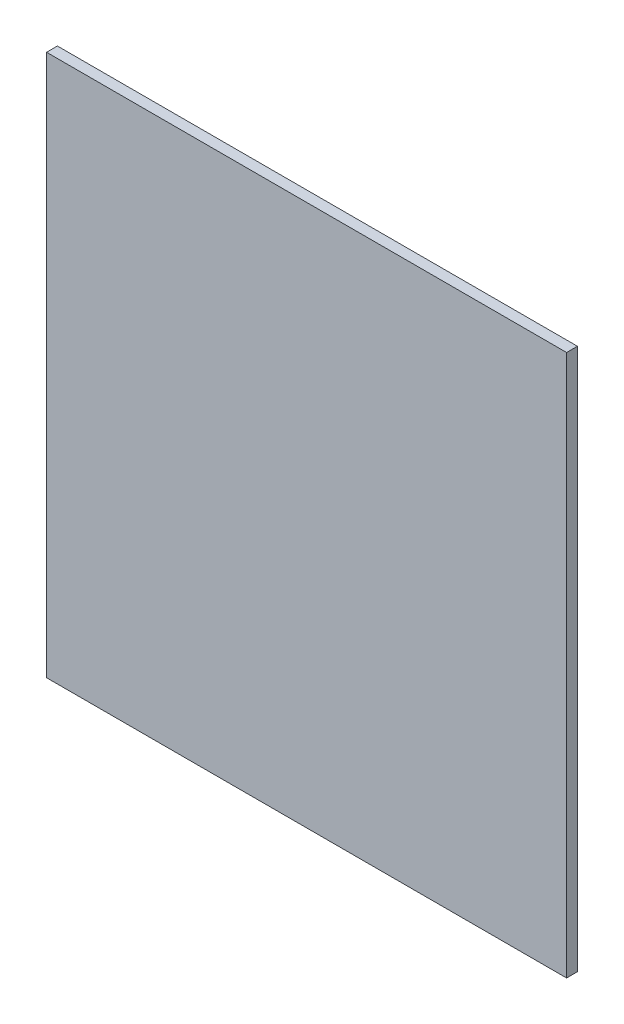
SolidWorks part; units mm, degrees
ref_plane "Front Plane" through (0, 0, 0) normal (1, 0, 0) x (0, 1, 0)
ref_plane "Top Plane" through (0, 0, 0) normal (0, 0, 1) x (0, 1, 0)
ref_plane "Right Plane" through (0, 0, 0) normal (0, 1, 0) x (-1, 0, 0)
sketch "Sketch1" plane through (0, 0, 0) normal (1, 0, 0) x (0, 1, 0)
  line L1 (-158.75, -158.75) -> (158.75, -158.75)
  line L2 (-158.75, -158.75) -> (-158.75, -152.4)
  line L3 (-158.75, -152.4) -> (158.75, -152.4)
  line L4 (158.75, -158.75) -> (158.75, -152.4)
extrude "Panel_or_block" add sketch "Sketch1" along normal blind 304.8
